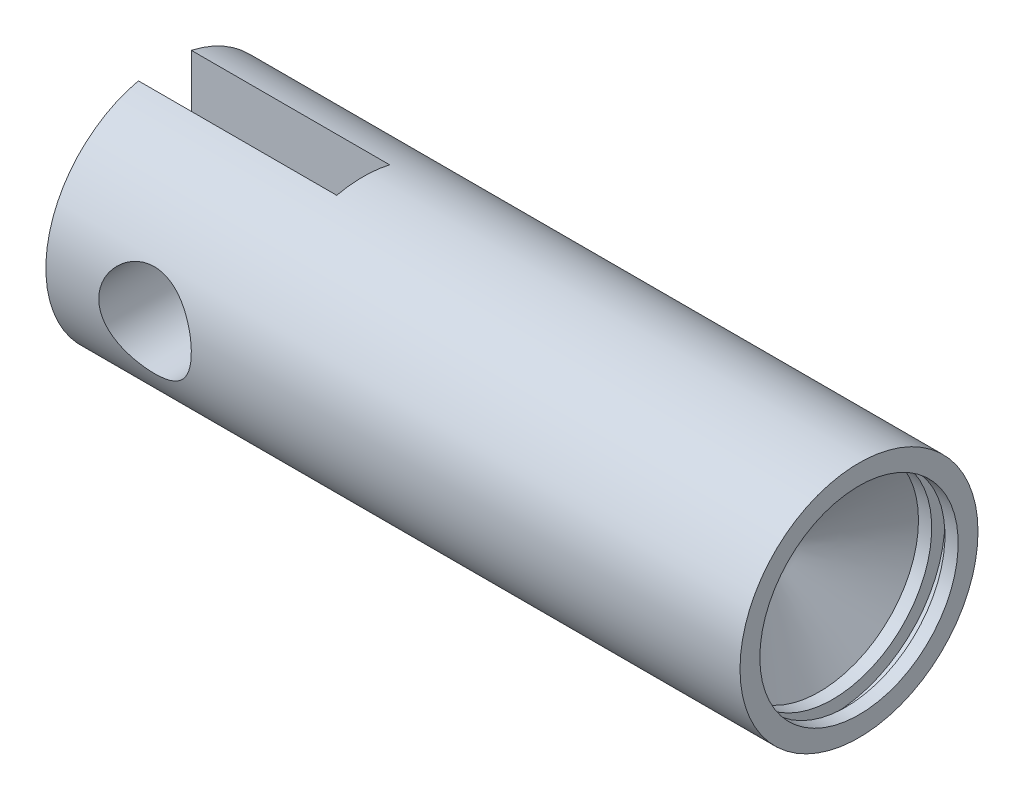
SolidWorks part; units mm, degrees
ref_plane "Plan de face" through (0, 0, 0) normal (0, 0, 1) x (1, 0, 0)
ref_plane "Plan de dessus" through (0, 0, 0) normal (0, 1, 0) x (1, 0, 0)
ref_plane "Plan de droite" through (0, 0, 0) normal (1, 0, 0) x (0, 0, -1)
sketch "Esquisse1" plane through (0, 0, 0) normal (0, 0, 1) x (1, 0, 0)
  line L0 (0, 18) -> (0, 0)
  line L1 (0, 0) -> (105, 0)
  line L2 (105, 0) -> (105, 18)
  line L3 (105, 18) -> (0, 18)
  line L4 (0, 0) -> (105, 0) construction
revolve "Révolution1" add sketch "Esquisse1" angle 360 about L4
sketch "Esquisse2" plane through (0, 0, 0) normal (-1, 0, 0) x (0, 0, 1)
  line L0 (-4, 17.5499) -> (-4, -17.5499)
  arc A0 (-4, -17.5499) -> (-4, 17.5499) centre (0, 0) ccw
extrude "Enlèv. mat.-Extru.1" cut sketch "Esquisse2" against normal blind 30
sketch "Esquisse3" plane through (30, 0, 0) normal (-1, 0, 0) x (0, 0, 1)
  line L0 (4, -17.5499) -> (4, 17.5499)
  arc A0 (4, 17.5499) -> (4, -17.5499) centre (0, 0) cw
extrude "Extrusion1" add sketch "Esquisse3" along normal blind 30
ref_plane "Plan4" through (0, 0, 0) normal (0, 0, -1) x (-1, 0, 0)
sketch "Esquisse4" plane through (0, 0, 0) normal (0, 0, -1) x (-1, 0, 0)
  line L0 (-105, 15) -> (-105, 0)
  line L1 (-105, 0) -> (-90.3397, 0)
  line L2 (-90.3397, 0) -> (-99, 15)
  line L3 (-99, 15) -> (-101, 15)
  line L4 (-101, 15) -> (-101, 17)
  line L5 (-101, 17) -> (-103, 17)
  line L6 (-103, 17) -> (-103, 15)
  line L7 (-103, 15) -> (-105, 15)
  line L8 (-105, 0) -> (-90.3396, 0) construction
revolve "Enlèvement de matière-Révolution1" cut sketch "Esquisse4" angle 360 about L8
hole_wizard "Diamètre du perçage M14.0 (14)1" positions "Esquisse6" profile "Esquisse5" hole size "M14.0" standard "Ansi Métrique"
sketch "Esquisse6" plane through (0, 0, 4) normal (0, 0, -1) x (-1, 0, 0)
  point P0 (-15, 0)
sketch "Esquisse5" plane through (15, 0, 4) normal (1, 0, 0) x (0, 1, 0)
  line L0 (0, 0) -> (0, 14)
  line L1 (0, 14) -> (7, 14)
  line L2 (7, 14) -> (7, 0)
  line L5 (7, 0) -> (0, 0)
  line L11 (0, -6.35) -> (0, 107.95) construction
  dimension "Diamètre du perçage jusqu'au prochain" = 14
  dimension "Profondeur du perçage jusqu'au prochain" = 14
hole_wizard "Diamètre du perçage M14.0 (14)2" positions "Esquisse8" profile "Esquisse7" hole size "M14.0" standard "Ansi Métrique"
sketch "Esquisse8" plane through (0, 0, -4) normal (0, 0, 1) x (1, 0, 0)
  point P0 (15, 0)
sketch "Esquisse7" plane through (15, 0, -4) normal (1, 0, 0) x (0, -1, 0)
  line L0 (0, 0) -> (0, 14)
  line L1 (0, 14) -> (7, 14)
  line L2 (7, 14) -> (7, 0)
  line L5 (7, 0) -> (0, 0)
  line L11 (0, -6.35) -> (0, 107.95) construction
  dimension "Diamètre du perçage jusqu'au prochain" = 14
  dimension "Profondeur du perçage jusqu'au prochain" = 14
